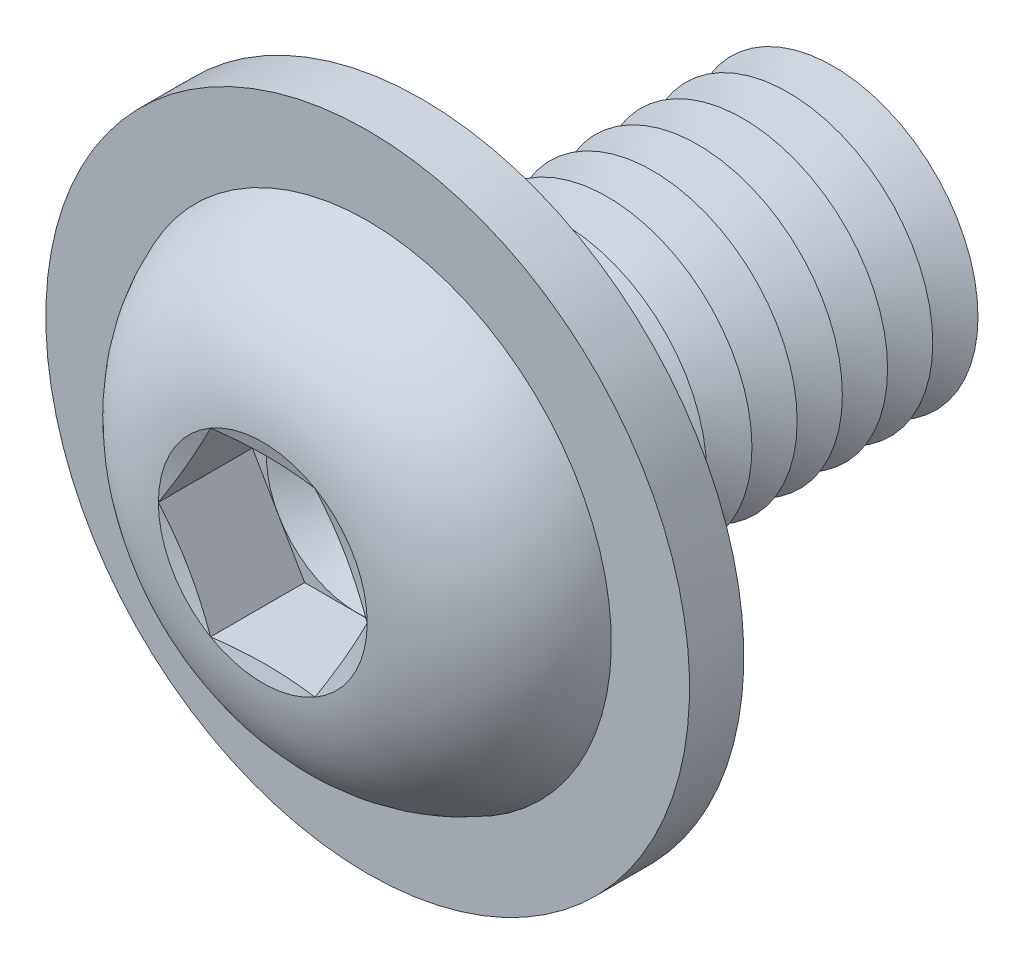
SolidWorks part; units mm, degrees
ref_plane "Front Plane" through (0, 0, 0) normal (0, 0, 1) x (1, 0, 0)
ref_plane "Top Plane" through (0, 0, 0) normal (0, 1, 0) x (1, 0, 0)
ref_plane "Right Plane" through (0, 0, 0) normal (1, 0, 0) x (0, 0, -1)
sketch "Sketch1" plane through (0, 0, 0) normal (1, 0, 0) x (0, 0, -1)
  line L0 (0, 4) -> (0, 7)
  line L3 (0, 4) -> (12, 4)
  line L4 (12, 4) -> (12, 0)
  line L5 (12, 0) -> (-4.4, 0) construction
  line L6 (-4.4, 0) -> (12, 0)
  line L7 (-4.4, 2.8867) -> (-4.4, 1.4434) construction
  line L8 (-4.4, 1.4434) -> (-4.4, 0)
  line L9 (-4.4, 2.8867) -> (-4.0132, 1.4434)
  line L10 (-4.0132, 1.4434) -> (-4.4, 1.4434)
  line L11 (12, 0) -> (22.7481, 0) construction
  line L12 (0, 7) -> (-4.4, 7) construction
  arc A1 (0, 7) -> (-4.4, 2.8867) centre (0, 2.59) ccw
  point P8 (12, 2)
  dimension "D1" = 14
  dimension "D2" = 8
  dimension "D3" = 4.4
  dimension "D4" = 5.7735
  dimension "D5" = 12
  dimension "D6" = 15
revolve "Revolve1" add sketch "Sketch1" angle 360 about L5
fillet "Fillet1" radius 0.625 1 edges at (-4, 0, 0)
sketch "Sketch2" plane through (0, 0, 0) normal (1, 0, 0) x (0, 0, -1)
  line L0 (11.375, 4) -> (12.625, 4)
  line L1 (12, 4) -> (0.625, 4) construction
  line L2 (12.625, 4) -> (12, 2.9175)
  line L3 (12, -4) -> (12, 4) construction
  line L4 (12, 2.9175) -> (11.375, 4)
  dimension "D1" = 1.25
revolve "Cut-Revolve1" cut sketch "Sketch2" angle 360 about axis through (0, 0, -12) along (0, 0, -1)
pattern_linear "LPattern1" count 9 spacing 1.25 along (0, 0, 1) of "Cut-Revolve1"
sketch "Sketch3" plane through (0, 0, 4.4) normal (0, 0, 1) x (1, 0, 0)
  line L7 (1.4434, 2.5) -> (-1.4434, 2.5)
  line L8 (-1.4434, 2.5) -> (-2.8867, 0)
  line L9 (-2.8867, 0) -> (-1.4434, -2.5)
  line L10 (-1.4434, -2.5) -> (1.4434, -2.5)
  line L11 (1.4434, -2.5) -> (2.8867, 0)
  line L12 (2.8867, 0) -> (1.4434, 2.5)
  circle A0 centre (0, 0) radius 2.5 construction
  circle A3 centre (0, 0) radius 2.8867 construction
extrude "Cut-Extrude1" cut sketch "Sketch3" against normal blind 2.6
sketch "Sketch4" plane through (0, 0, 1.8) normal (0, 0, 1) x (1, 0, 0)
  line L1 (1.4434, 2.5) -> (-1.4434, 2.5) construction
  circle A0 centre (0, 0) radius 2.5
extrude "Cut-Extrude2" cut sketch "Sketch4" against normal through all draft 60
sketch "Sketch5" plane through (0, 0, 0) normal (0, 0, -1) x (-1, 0, 0)
  circle A0 centre (0, 0) radius 8.9
  circle A1 centre (0, 0) radius 4.625
  circle A2 centre (0, 0) radius 4.625 construction
  dimension "D1" = 17.8
extrude "Boss-Extrude1" add sketch "Sketch5" against normal blind 1.5
